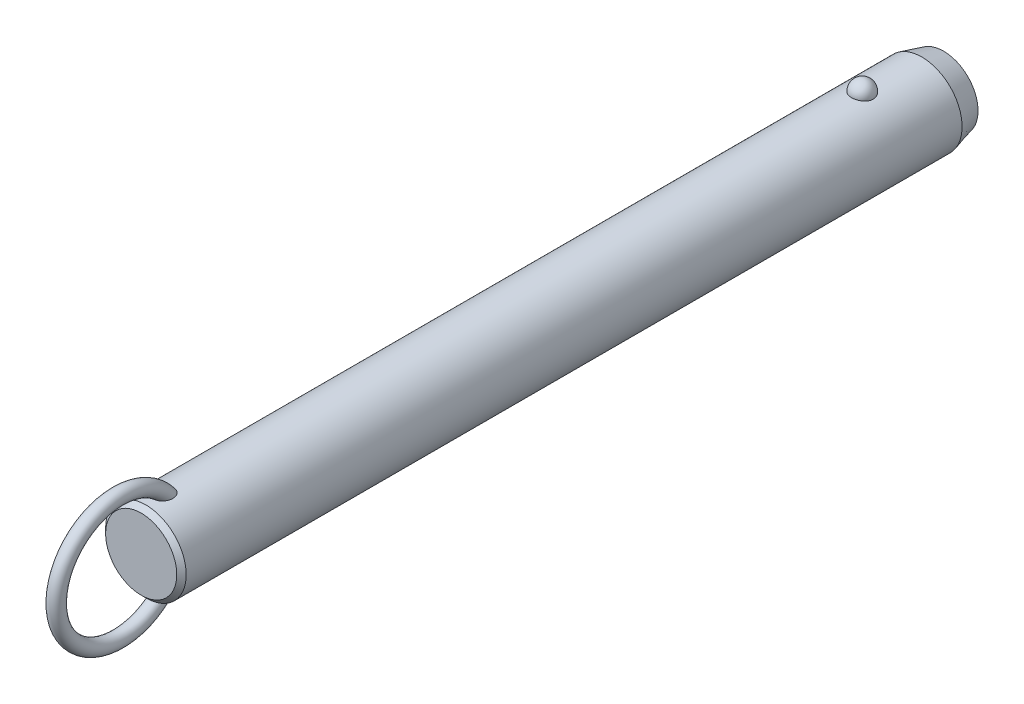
SolidWorks part; units mm, degrees
ref_plane "Front Plane" through (0, 0, 0) normal (0, 0, 1) x (1, 0, 0)
ref_plane "Top Plane" through (0, 0, 0) normal (0, 1, 0) x (1, 0, 0)
ref_plane "Right Plane" through (0, 0, 0) normal (1, 0, 0) x (0, 0, -1)
sketch "Sketch2" plane through (0, 0, 0) normal (0, 0, 1) x (1, 0, 0)
  circle A0 centre (0, 0) radius 11.1
  point P3 (0, 11.1)
  dimension "D1" = 22.2
extrude "Boss-Extrude1" add sketch "Sketch2" along normal blind 182.9
sketch "Sketch3" plane through (0, 0, 0) normal (0, 0, -1) x (-1, 0, 0)
  circle A0 centre (0, 0) radius 11.1
  dimension "D1" = 22.2
extrude "Boss-Extrude2" add sketch "Sketch3" along normal blind 25.4
chamfer "Chamfer1" distance 6 angle 15 1 edges at (-11.1, 0, -25.4)
sketch "Sketch12" plane through (0, 0, 0) normal (1, 0, 0) x (0, 0, -1)
  line L0 (-182.9, 11.1) -> (-182.9, -11.1) construction
  point P0 (-182.9, 0)
sketch "Sketch13" plane through (0, 0, 0) normal (1, 0, 0) x (0, 0, -1)
  circle A0 centre (-201.95, 0) radius 19.05
  point P2 (-182.9, 0)
  dimension "D1" = 38.1
sketch "Sketch14" plane through (0, 0, 0) normal (0, 1, 0) x (1, 0, 0)
  circle A0 centre (0, -184.9) radius 2
  point P2 (0, -182.9)
  dimension "D1" = 4
sweep "Sweep1" add profiles "Sketch14" path "Sketch13"
sketch "Sketch15" plane through (0, 0, 182.9) normal (0, 0, 1) x (1, 0, 0)
  circle A0 centre (0, 0) radius 11.1
  dimension "D1" = 22.2
extrude "Boss-Extrude3" add sketch "Sketch15" along normal blind 12.7
chamfer "Chamfer2" distance 1.3 angle 45 1 edges at (11.1, 0, 195.6)
sketch "Sketch18" plane through (0, 0, 0) normal (1, 0, 0) x (0, 0, -1)
  line L0 (19.4, 11.1) -> (-186.468, 11.1) construction
  line L1 (3, 14.1) -> (3, 8.1)
  line L2 (-186.468, -11.1) -> (19.4, -11.1) construction
  arc A0 (3, 14.1) -> (3, 8.1) centre (3, 11.1) ccw
  point P4 (0, 11.1)
  dimension "D1" = 25.2
revolve "Revolve1" add sketch "Sketch18" angle 360 about L1
